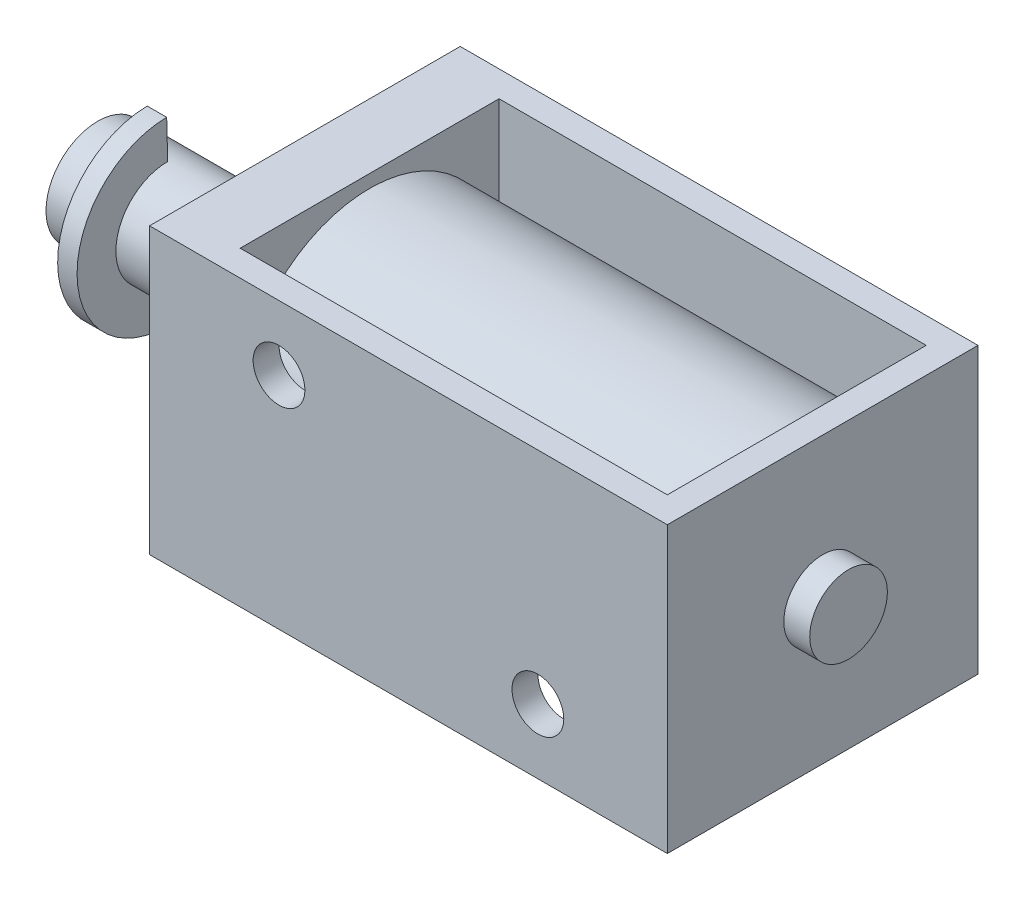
SolidWorks part; units mm, degrees
ref_plane "Front Plane" through (0, 0, 0) normal (0, 0, 1) x (1, 0, 0)
ref_plane "Top Plane" through (0, 0, 0) normal (0, 1, 0) x (1, 0, 0)
ref_plane "Right Plane" through (0, 0, 0) normal (1, 0, 0) x (0, 0, -1)
sketch "Sketch1" plane through (0, 0, 0) normal (0, 1, 0) x (1, 0, 0)
  line L1 (0, 0) -> (20, 0)
  line L2 (0, 0) -> (0, 12)
  line L3 (0, 12) -> (20, 12)
  line L4 (20, 0) -> (20, 12)
  dimension "D1" = 12
  dimension "D2" = 20
extrude "Boss-Extrude1" add sketch "Sketch1" along normal blind 11
sketch "Sketch3" plane through (0, 11, 0) normal (0, 1, 0) x (1, 0, 0)
  line L0 (0, 12) -> (20, 12) construction
  line L1 (2.5, 11) -> (19, 11)
  line L2 (2.5, 11) -> (2.5, 1)
  line L3 (2.5, 1) -> (19, 1)
  line L4 (19, 11) -> (19, 1)
  line L5 (0, 0) -> (20, 0) construction
  line L6 (20, 0) -> (20, 12) construction
  line L7 (0, 12) -> (0, 0) construction
  dimension "D1" = 1
  dimension "D2" = 1
  dimension "D3" = 1
  dimension "D4" = 2.5
extrude "Cut-Extrude1" cut sketch "Sketch3" against normal through all
sketch "Sketch4" plane through (2.5, 0, 0) normal (1, 0, 0) x (0, 0, -1)
  line L0 (6, 11) -> (6, 0) construction
  line L1 (0, 11) -> (12, 11) construction
  line L2 (0, 0) -> (12, 0) construction
  line L3 (11, 0) -> (11, 11) construction
  circle A0 centre (6, 5.5) radius 5
extrude "Boss-Extrude3" add sketch "Sketch4" along normal up to next separate body
sketch "Sketch5" plane through (0, 0, 0) normal (-1, 0, 0) x (0, 0, 1)
  line L0 (-12, 5.5) -> (0, 5.5) construction
  line L1 (-12, 11) -> (-12, 0) construction
  line L2 (0, 11) -> (0, 0) construction
  circle A0 centre (-6, 5.5) radius 2
  dimension "D1" = 4
extrude "Boss-Extrude4" add sketch "Sketch5" along normal blind 8
sketch "Sketch6" plane through (20, 0, 0) normal (1, 0, 0) x (0, 0, -1)
  line L0 (12, 5.5) -> (0, 5.5) construction
  line L1 (12, 11) -> (12, 0) construction
  line L2 (0, 11) -> (0, 0) construction
  circle A0 centre (6, 5.5) radius 1.5
  dimension "D1" = 3
extrude "Boss-Extrude5" add sketch "Sketch6" along normal blind 1
ref_plane "Plane2" through (-5.3, 0, 0) normal (-1, 0, 0) x (0, 0, 1)
sketch "Sketch7" plane through (-5.3, 0, 0) normal (-1, 0, 0) x (0, 0, 1)
  line L0 (-6, 7.5) -> (-5.9615, 8.9998)
  line L1 (-6, 3.5) -> (-6, 2)
  arc A0 (-6, 3.5) -> (-6, 7.5) centre (-6, 5.5) ccw
  circle A1 centre (-6, 5.5) radius 2 construction
  circle A2 centre (-6, 5.5) radius 2 construction
  arc A3 (-6, 2) -> (-5.9615, 8.9998) centre (-6, 5.5) ccw
  dimension "D1" = 3.5
extrude "Boss-Extrude6" add sketch "Sketch7" along normal blind 0.75
sketch "Schizzo1" plane through (0, 0, 0) normal (0, 0, 1) x (1, 0, 0)
  line L0 (20, 11) -> (15, 11) construction
  line L1 (0, 11) -> (20, 11) construction
  line L2 (15, 11) -> (15, 0) construction
  line L3 (0, 0) -> (20, 0) construction
  line L4 (15, 0) -> (5, 0) construction
  line L5 (5, 0) -> (5, 11) construction
  line L6 (20, 11) -> (20, 0) construction
  line L7 (20, 5.5) -> (0, 5.5) construction
  line L8 (0, 7.5) -> (0, 3.5) construction
  line L9 (20, 8.5) -> (0, 8.5) construction
  line L10 (0, 11) -> (0, 0) construction
  line L11 (20, 2.5) -> (0, 2.5) construction
  line L12 (20, 8.5) -> (20, 2.5) construction
  circle A0 centre (15, 2.5) radius 1
  circle A1 centre (5, 8.5) radius 1
  point P22 (15, 5.5)
  point P27 (20, 5.5)
  dimension "D4" = 2
  dimension "D1" = 5
  dimension "D2" = 10
  dimension "D3" = 6
extrude "Taglio-Estrusione1" cut sketch "Schizzo1" against normal blind 2
